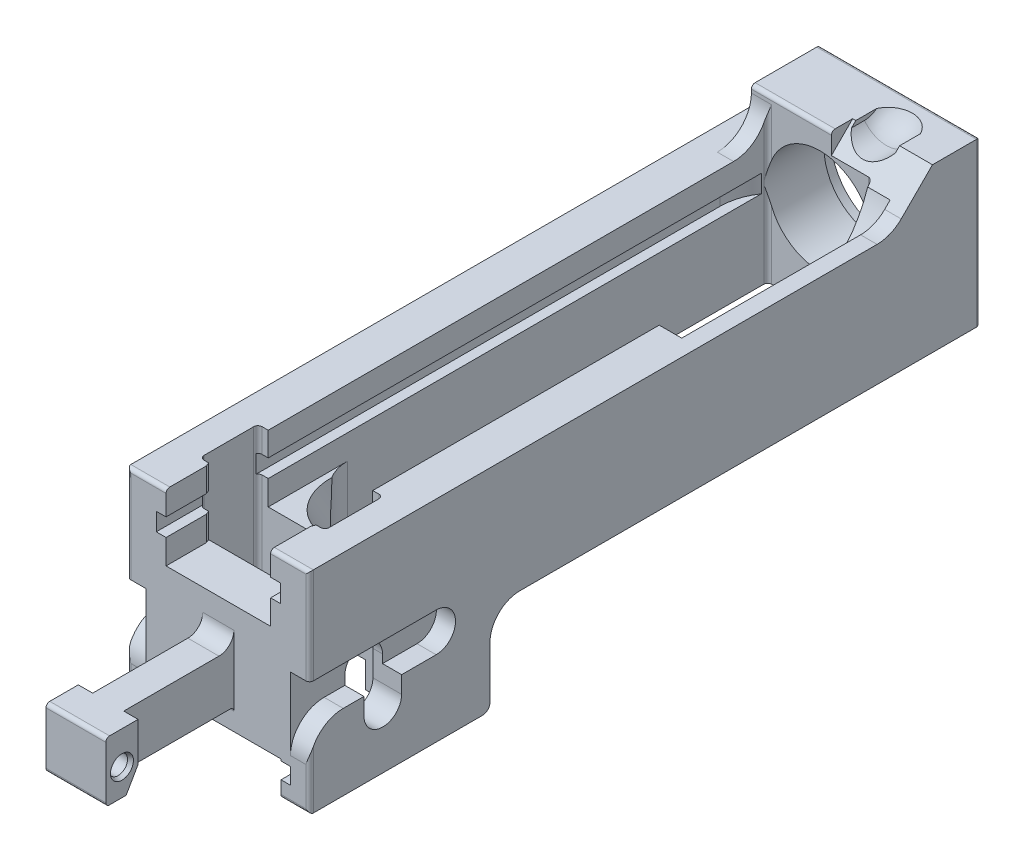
SolidWorks part; units mm, degrees
ref_plane "Спереди" through (0, 0, 0) normal (0, 0, 1) x (1, 0, 0)
ref_plane "Сверху" through (0, 0, 0) normal (0, 1, 0) x (1, 0, 0)
ref_plane "Справа" through (0, 0, 0) normal (1, 0, 0) x (0, 0, -1)
sketch "Эскиз1" plane through (0, 0, 0) normal (1, 0, 0) x (0, 0, -1)
  line L0 (-142.4178, 7.1882) -> (-21.8948, 7.1882)
  line L1 (-14.6558, 14.4272) -> (-14.6558, 15.1574)
  line L2 (-13.862, 15.9512) -> (0, 15.9512)
  line L3 (0, 15.9512) -> (0, -18.5928)
  line L4 (0, -18.5928) -> (-97.7646, -18.5928)
  line L5 (-104.1146, -24.9428) -> (-104.1146, -35.9537)
  line L6 (-105.7021, -37.5412) -> (-142.4178, -37.5412)
  line L7 (-142.4178, -37.5412) -> (-142.4178, 7.1882)
  line L8 (-126.873, -25.0825) -> (-126.873, -19.6723) construction
  line L9 (-130.8735, -25.0825) -> (-130.8735, -19.6723)
  line L10 (-122.8725, -25.0825) -> (-122.8725, -19.6723)
  arc A0 (-130.8735, -25.0825) -> (-122.8725, -25.0825) centre (-126.873, -25.0825) ccw
  arc A1 (-122.8725, -19.6723) -> (-130.8735, -19.6723) centre (-126.873, -19.6723) ccw
  arc A2 (-97.7646, -18.5928) -> (-104.1146, -24.9428) centre (-97.7646, -24.9428) ccw
  arc A3 (-21.8948, 7.1882) -> (-14.6558, 14.4272) centre (-21.8948, 14.4272) ccw
  arc A8 (-14.6558, 15.1574) -> (-13.862, 15.9512) centre (-13.862, 15.1574) cw
  arc A9 (-104.1146, -35.9537) -> (-105.7021, -37.5412) centre (-105.7021, -35.9537) cw
  point P11 (-126.873, -22.3774)
  dimension "D12" = 6.35
  dimension "D13" = 7.239
  dimension "D14" = 0.7937
  dimension "D15" = 1.5875
  dimension "D1" = 38.3032
  dimension "D2" = 14.6558
  dimension "D3" = 142.4178
  dimension "D4" = 37.5412
  dimension "D5" = 34.544
  dimension "D6" = 25.781
  dimension "D7" = 8.001
  dimension "D8" = 126.873
  dimension "D9" = 5.4102
  dimension "D10" = 12.4587
  dimension "D11" = 44.7294
extrude "Бобышка-Вытянуть1" add sketch "Эскиз1" along normal mid plane 38.7604
sketch "Эскиз2" plane through (0, 0, 0) normal (1, 0, 0) x (0, 0, -1)
  line L0 (-142.4178, -11.557) -> (-142.4178, -26.4478)
  line L1 (-145.5928, -14.732) -> (-172.6692, -14.732)
  line L2 (-172.6692, -14.732) -> (-172.6692, -27.432)
  line L3 (-172.6692, -27.432) -> (-168.3512, -27.432)
  line L4 (-163.9445, -25.654) -> (-143.2116, -25.654)
  line L5 (-142.4178, 7.1882) -> (-142.4178, -37.5412) construction
  line L6 (-142.4178, -37.5412) -> (-105.7021, -37.5412) construction
  line L7 (-97.7646, -18.5928) -> (0, -18.5928) construction
  arc A0 (-143.2116, -25.654) -> (-142.4178, -26.4478) centre (-143.2116, -26.4478) cw
  arc A1 (-145.5928, -14.732) -> (-142.4178, -11.557) centre (-145.5928, -11.557) ccw
  arc A2 (-168.3512, -27.432) -> (-163.9445, -25.654) centre (-163.9445, -32.004) cw
  circle A3 centre (-169.2402, -21.7678) radius 1.9812
  dimension "D1" = 3.175
  dimension "D2" = 0.7937
  dimension "D10" = 6.35
  dimension "D11" = 3.9624
  dimension "D3" = 22.8092
  dimension "D4" = 4.318
  dimension "D5" = 1.778
  dimension "D6" = 12.7
  dimension "D7" = 172.6692
  dimension "D8" = 26.8224
  dimension "D9" = 3.175
extrude "Бобышка-Вытянуть2" add sketch "Эскиз2" along normal mid plane 6.604
sketch "Эскиз3" plane through (0, 0, 0) normal (1, 0, 0) x (0, 0, -1)
  line L0 (-165.8112, -14.732) -> (-172.6692, -14.732)
  line L1 (-172.6692, -14.732) -> (-172.6692, -27.432)
  line L2 (-172.6692, -27.432) -> (-168.3512, -27.432)
  line L3 (-168.3512, -27.432) -> (-165.8112, -23.0326)
  line L4 (-165.8112, -23.0326) -> (-165.8112, -14.732)
  line L5 (-172.6692, -27.432) -> (-168.3512, -27.432) construction
  line L6 (-145.5928, -14.732) -> (-172.6692, -14.732) construction
  line L7 (-172.6692, -14.732) -> (-172.6692, -27.432) construction
  circle A0 centre (-169.2402, -21.7678) radius 1.9812
  circle A1 centre (-169.2402, -21.7678) radius 1.9812 construction
  dimension "D1" = 30
  dimension "D2" = 6.858
extrude "Бобышка-Вытянуть3" add sketch "Эскиз3" along normal mid plane 12.7
fillet "Скругление1" radius 0.7937 2 edges at (0, -27.432, 172.6692) (0, -14.732, 172.6692)
sketch "Эскиз6" plane through (0, -37.5412, 0) normal (0, -1, 0) x (1, 0, 0)
  line L0 (0, 0) -> (0, 156.9321) construction
  line L2 (12.3952, 120.7262) -> (-12.3952, 120.7262)
  line L3 (13.2842, 121.6152) -> (13.2842, 132.1816)
  line L4 (12.3952, 133.0706) -> (-12.3952, 133.0706)
  line L5 (-13.2842, 121.6152) -> (-13.2842, 132.1816)
  arc A0 (-12.3952, 133.0706) -> (-13.2842, 132.1816) centre (-12.3952, 132.1816) ccw
  arc A1 (-12.3952, 120.7262) -> (-13.2842, 121.6152) centre (-12.3952, 121.6152) cw
  arc A2 (12.3952, 120.7262) -> (13.2842, 121.6152) centre (12.3952, 121.6152) ccw
  arc A3 (13.2842, 132.1816) -> (12.3952, 133.0706) centre (12.3952, 132.1816) ccw
  dimension "D4" = 0.889
  dimension "D1" = 12.3444
  dimension "D2" = 120.7262
  dimension "D3" = 26.5684
extrude "Вырез-Вытянуть1" cut sketch "Эскиз6" against normal through all
sketch "Эскиз5" plane through (0, 15.9512, 0) normal (0, 1, 0) x (1, 0, 0)
  line L0 (0, 12.508) -> (0, -154.566) construction
  line L2 (-10.306, -14.6558) -> (10.306, -14.6558)
  line L3 (-11.0998, -15.4496) -> (-11.0998, -103.9177)
  line L4 (-2.3685, -112.649) -> (2.3685, -112.649)
  line L5 (11.0998, -15.4496) -> (11.0998, -103.9177)
  line L6 (-12.3952, -120.7262) -> (12.3952, -120.7262) construction
  line L7 (19.3802, 0) -> (-19.3802, 0) construction
  arc A0 (2.3685, -112.649) -> (11.0998, -103.9177) centre (2.3686, -103.9177) ccw
  arc A1 (-11.0998, -103.9177) -> (-2.3685, -112.649) centre (-2.3685, -103.9177) ccw
  arc A2 (10.306, -14.6558) -> (11.0998, -15.4496) centre (10.3061, -15.4495) cw
  arc A3 (-10.306, -14.6558) -> (-11.0998, -15.4496) centre (-10.306, -15.4495) ccw
  dimension "D4" = 8.7312
  dimension "D5" = 0.7937
  dimension "D1" = 22.1996
  dimension "D2" = 14.6558
  dimension "D3" = 8.0772
extrude "Вырез-Вытянуть2" cut sketch "Эскиз5" against normal through all
sketch "Эскиз7" plane through (0, 0, 0) normal (1, 0, 0) x (0, 0, -1)
  line L0 (0, 0) -> (-34.8934, 0) construction
  line L1 (0, 0) -> (0, 12.3571)
  line L2 (0, 12.3571) -> (-2.667, 12.3571)
  line L3 (-2.667, 12.3571) -> (-2.667, 11.11)
  line L4 (-2.667, 11.11) -> (-15.4496, 11.11)
  line L5 (-15.4496, 11.11) -> (-15.4496, 0)
  line L6 (-15.4496, 0) -> (0, 0)
  line L8 (-15.4496, -18.5928) -> (-15.4496, 11.1315) construction
  dimension "D1" = 24.7142
  dimension "D2" = 2.667
  dimension "D3" = 22.2199
revolve "Вырез-Повернуть1" cut sketch "Эскиз7" angle 360 about L0
sketch "Эскиз8" plane through (0, 7.1882, 0) normal (0, 1, 0) x (1, 0, 0)
  line L0 (-11.0998, -103.9177) -> (-11.0998, -21.8948) construction
  line L1 (-11.0998, -103.9177) -> (11.0998, -103.9177)
  line L2 (-11.0998, -103.9177) -> (-11.0998, -120.7262)
  line L3 (-11.0998, -142.4178) -> (11.0998, -142.4178)
  line L4 (11.0998, -103.9177) -> (11.0998, -120.7262)
  line L5 (11.0998, -21.8948) -> (11.0998, -103.9177) construction
  line L7 (11.8936, -130.0577) -> (11.8936, -120.7262)
  line L8 (11.8936, -120.7262) -> (11.0998, -120.7262)
  line L9 (-11.8935, -120.7262) -> (-11.8935, -130.0577)
  line L10 (12.3952, -133.0706) -> (-12.3952, -133.0706) construction
  line L11 (-12.3952, -120.7262) -> (12.3952, -120.7262) construction
  line L12 (-11.0998, -133.8644) -> (-11.0998, -142.4178)
  line L13 (11.0998, -133.8644) -> (11.0998, -142.4178)
  line L14 (-11.0998, -120.7262) -> (-11.8935, -120.7262)
  line L15 (19.3802, -142.4178) -> (-19.3802, -142.4178) construction
  arc A0 (-11.8935, -130.0577) -> (-11.0998, -133.8644) centre (-2.3685, -130.0577) ccw
  arc A1 (11.8936, -130.0577) -> (11.0998, -133.8644) centre (2.3686, -130.0577) cw
  dimension "D1" = 9.525
  dimension "D2" = 0.7937
  dimension "D3" = 0.7937
extrude "Вырез-Вытянуть3" cut sketch "Эскиз8" against normal blind 14.1224
sketch "Эскиз9" plane through (0, 0, 142.4178) normal (0, 0, 1) x (1, 0, 0)
  line L0 (0, 0) -> (0, -48.6902) construction
  line L1 (-13.3096, -30.226) -> (13.3096, -30.226)
  line L2 (13.3096, -30.226) -> (13.3096, -30.607)
  line L3 (13.3096, -30.607) -> (15.3162, -30.607)
  line L4 (15.3162, -30.607) -> (15.3162, -34.0614)
  line L5 (15.3162, -34.0614) -> (13.3096, -34.0614)
  line L6 (13.3096, -34.0614) -> (13.3096, -37.5412)
  line L7 (13.3096, -37.5412) -> (-13.3096, -37.5412)
  line L9 (-13.3096, -34.0614) -> (-13.3096, -37.5412)
  line L10 (-15.3162, -34.0614) -> (-13.3096, -34.0614)
  line L11 (-15.3162, -30.607) -> (-15.3162, -34.0614)
  line L12 (-13.3096, -30.607) -> (-15.3162, -30.607)
  line L13 (-13.3096, -30.226) -> (-13.3096, -30.607)
  line L14 (19.3802, -37.5412) -> (-19.3802, -37.5412) construction
  point P14 (0, -37.5412)
  point P19 (0, -30.226)
  dimension "D1" = 3.4798
  dimension "D2" = 3.4544
  dimension "D3" = 26.6192
  dimension "D4" = 30.6324
  dimension "D5" = 7.3152
extrude "Вырез-Вытянуть4" cut sketch "Эскиз9" against normal up to surface (38.3032 mm away)
ref_plane "Плоскость1" through (0, 2.0828, 0) normal (0, 1, 0) x (1, 0, 0)
sketch "Эскиз10" plane through (0, 2.0828, 0) normal (0, 1, 0) x (1, 0, 0)
  line L0 (0, 0) -> (0, -217.0194) construction
  line L1 (-11.0998, -142.4178) -> (11.0998, -142.4178) construction
  line L2 (-10.0076, -14.6558) -> (10.0076, -14.6558)
  line L3 (-13.1826, -22.6628) -> (-13.1826, -142.4178)
  line L4 (-13.1826, -142.4178) -> (13.1826, -142.4178)
  line L5 (13.1826, -22.6628) -> (13.1826, -142.4178)
  line L6 (19.3802, -14.6558) -> (-19.3802, -14.6558) construction
  arc A0 (-13.1826, -22.6628) -> (-10.0076, -14.6558) centre (-1.4986, -22.6628) cw
  arc A1 (13.1826, -22.6628) -> (10.0076, -14.6558) centre (1.4986, -22.6628) ccw
  dimension "D2" = 11.684
  dimension "D1" = 26.3652
  dimension "D3" = 3.175
extrude "Вырез-Вытянуть5" cut sketch "Эскиз10" against normal blind 3.7846
fillet "Скругление2" radius 0.7937 10 edges at (19.3802, -1.3208, 0) (0, 15.9512, 0) (-19.3802, -1.3208, 0) (0, -18.5928, 0) (-16.3449, -37.5412, 142.4178) (16.3449, -37.5412, 142.4178) (19.3802, -15.1765, 142.4178) (15.24, 7.1882, 142.4178) (-15.24, 7.1882, 142.4178) (-19.3802, -15.1765, 142.4178)
sketch "Эскиз11" plane through (19.3802, 0, 0) normal (1, 0, 0) x (0, 0, -1)
  line L0 (-142.4178, -28.6068) -> (-142.4178, -13.2334)
  line L2 (-142.4178, -13.2334) -> (-115.5446, -13.2334)
  line L3 (-135.2741, -21.463) -> (-115.5446, -21.463)
  line L4 (-141.6241, -37.5412) -> (-105.7021, -37.5412) construction
  line L5 (-142.4178, -26.4478) -> (-142.4178, -11.557) construction
  arc A0 (-115.5446, -21.463) -> (-115.5446, -13.2334) centre (-115.5446, -17.3482) ccw
  arc A1 (-142.4178, -28.6068) -> (-135.2741, -21.463) centre (-135.2741, -28.6068) cw
  point P11 (-111.4298, -17.3482)
  dimension "D2" = 7.1437
  dimension "D1" = 24.3078
  dimension "D3" = 8.2296
  dimension "D4" = 30.988
extrude "Вырез-Вытянуть6" cut sketch "Эскиз11" against normal blind 4.064
mirror "Зеркальное отражение1" about plane through (0, 0, 0) normal (1, 0, 0) of "Вырез-Вытянуть6"
chamfer "Фаска1" distance 0.7937 angle 30 2 edges at (-6.35, -21.7678, 167.259) (6.35, -21.7678, 167.259)
sketch "Эскиз12" plane through (0, 0, 0) normal (1, 0, 0) x (0, 0, -1)
  line L0 (-119.0426, 11.0826) -> (-89.8309, -39.5136) construction
  line L1 (-111.4636, -2.0447) -> (-119.9325, -6.9342)
  line L2 (-119.9325, -6.9342) -> (-103.662, -35.1155)
  line L3 (-103.662, -35.1155) -> (-95.1931, -30.226)
  line L4 (-95.1931, -30.226) -> (-111.4636, -2.0447)
  line L5 (-120.7262, -6.9342) -> (-120.7262, -1.7018) construction
  line L6 (-103.9177, -6.9342) -> (-120.7262, -6.9342) construction
  line L7 (-104.1146, -30.226) -> (-142.4178, -30.226) construction
  dimension "D1" = 9.779
  dimension "D2" = 30
  dimension "D3" = 0.7937
revolve "Вырез-Повернуть2" cut sketch "Эскиз12" angle 360 about L0
sketch "Эскиз13" plane through (0, -37.5412, 0) normal (0, -1, 0) x (1, 0, 0)
  line L0 (-12.3952, 120.7262) -> (12.3952, 120.7262) construction
  line L1 (9.5885, 97.7646) -> (-9.5885, 97.7646)
  line L2 (9.5885, 97.7646) -> (9.5885, 120.7262)
  line L3 (9.5885, 120.7262) -> (-9.5885, 120.7262)
  line L4 (-9.5885, 97.7646) -> (-9.5885, 120.7262)
  line L7 (19.3802, 97.7646) -> (11.0998, 97.7646) construction
  line L8 (0, 97.7646) -> (0, 0) construction
  dimension "D1" = 19.177
extrude "Вырез-Вытянуть8" cut sketch "Эскиз13" against normal blind 12.827 contours L1 L4 L3 L2
sketch "Эскиз14" plane through (0, 0, 0) normal (0, 0, -1) x (-1, 0, 0)
  line L1 (14.5542, 15.9512) -> (19.3802, 15.9512)
  line L2 (14.5542, 15.9512) -> (14.5542, 7.1882)
  line L3 (14.5542, 7.1882) -> (19.3802, 7.1882)
  line L4 (19.3802, 15.9512) -> (19.3802, 7.1882)
  line L7 (11.0998, 7.1882) -> (19.3802, 7.1882) construction
  line L8 (-19.3802, 15.9512) -> (19.3802, 15.9512) construction
  line L9 (19.3802, 15.9512) -> (19.3802, -18.5928) construction
  dimension "D1" = 4.826
extrude "Вырез-Вытянуть9" cut sketch "Эскиз14" against normal through all
sketch "Эскиз15" plane through (13.2842, 0, 0) normal (-1, 0, 0) x (0, 0, 1)
  line L0 (132.1816, -30.226) -> (134.6581, -30.226)
  line L1 (134.6581, -30.226) -> (132.1816, -27.7495)
  line L2 (132.1816, 7.1882) -> (132.1816, -30.226) construction
  line L3 (132.1816, -27.7495) -> (132.1816, -30.226)
  line L4 (133.0706, -1.7018) -> (133.0706, -30.226) construction
  dimension "D1" = 1.5875
  dimension "D2" = 45
extrude "Вырез-Вытянуть10" cut sketch "Эскиз15" along normal up to surface (26.5684 mm away)
sketch "Эскиз16" plane through (11.0998, 0, 0) normal (-1, 0, 0) x (0, 0, 1)
  line L0 (21.8948, 7.1882) -> (120.7262, 7.1882) construction
  line L2 (142.4178, 7.1882) -> (142.4178, -13.2334) construction
  circle A0 centre (38.4048, 17.6022) radius 23.876
  point P7 (38.4048, -6.2738)
  dimension "D1" = 23.876
  dimension "D2" = 104.013
  dimension "D3" = 13.462
extrude "Вырез-Вытянуть11" cut sketch "Эскиз16" against normal offset from surface (4.7752 mm away) 3.5052
sketch "Эскиз17" plane through (19.3802, 0, 0) normal (1, 0, 0) x (0, 0, -1)
  line L0 (-10.1333, 15.9512) -> (-16.7761, 15.9512)
  line L1 (-0.7937, 15.9512) -> (-13.862, 15.9512) construction
  line L2 (-16.7761, 15.9512) -> (-16.7761, 9.3085)
  line L3 (-16.7761, 9.3085) -> (-10.1333, 15.9512)
  arc A0 (-21.8948, 7.1882) -> (-14.6558, 14.4272) centre (-21.8948, 14.4272) ccw construction
  dimension "D1" = 45
extrude "Вырез-Вытянуть12" cut sketch "Эскиз17" against normal blind 16.9418
ref_plane "Плоскость2" through (7.747, 0, 0) normal (-1, 0, 0) x (0, 0, 1)
sketch "Эскиз18" plane through (7.747, 0, 0) normal (-1, 0, 0) x (0, 0, 1)
  line L0 (14.6558, 12.7508) -> (8.292, 12.7508)
  line L1 (0.7937, 15.9512) -> (10.1333, 15.9512) construction
  line L2 (0, -18.5928) -> (0, 15.9512) construction
  line L3 (14.6558, 15.1574) -> (14.6558, 11.4287) construction
  arc A0 (8.292, 12.7508) -> (2.7781, 15.9512) centre (8.292, 19.1008) cw
  dimension "D1" = 6.35
  dimension "D2" = 3.2004
  dimension "D3" = 2.7781
sketch "Эскиз19" plane through (0, 0, 14.6558) normal (0, 0, 1) x (1, 0, 0)
  line L0 (7.747, 12.7508) -> (7.747, 22.7869) construction
  line L1 (3.0988, 15.0376) -> (3.0988, 19.1008)
  line L2 (3.0988, 19.1008) -> (12.3952, 19.1008)
  line L3 (12.3952, 19.1008) -> (12.3952, 15.0376)
  arc A0 (3.0988, 15.0376) -> (12.3952, 15.0376) centre (7.747, 18.6182) ccw
  point P3 (7.747, 12.7508)
  dimension "D3" = 5.8674
  dimension "D1" = 9.2964
  dimension "D2" = 6.35
sweep "Вырез-По траектории1" cut profiles "Эскиз19" path "Эскиз18"
sketch "Эскиз20" plane through (-19.3802, 0, 0) normal (-1, 0, 0) x (0, 0, 1)
  line L0 (31.75, 4.0386) -> (0, 4.0386)
  line L1 (0, 4.0386) -> (0, -4.0386)
  line L2 (0, -4.0386) -> (31.75, -4.0386)
  line L3 (0, 0) -> (54.1782, 0) construction
  line L4 (51.0032, 3.175) -> (34.2459, 3.175)
  line L6 (34.2459, -3.175) -> (51.0032, -3.175)
  arc A0 (31.75, 4.0386) -> (34.2459, 3.175) centre (31.75, 0) cw
  arc A1 (51.0032, 3.175) -> (51.0032, -3.175) centre (51.0032, 0) cw
  arc A2 (34.2459, -3.175) -> (31.75, -4.0386) centre (31.75, 0) cw
  dimension "D3" = 3.175
  dimension "D1" = 8.0772
  dimension "D2" = 31.75
  dimension "D4" = 54.1782
extrude "Вырез-Вытянуть13" cut sketch "Эскиз20" against normal blind 2.032
sketch "Эскиз21" plane through (-17.3482, 0, 0) normal (-1, 0, 0) x (0, 0, 1)
  line L0 (51.0032, 4.0386) -> (0, 4.0386)
  line L1 (0, 4.0386) -> (0, -4.0386)
  line L2 (0.7937, -4.0386) -> (31.75, -4.0386) construction
  line L3 (0, -4.0386) -> (51.0032, -4.0386)
  line L4 (31.75, 4.0386) -> (0.7937, 4.0386) construction
  line L5 (0, 4.0386) -> (0, -4.0386) construction
  arc A0 (51.0032, -4.0386) -> (51.0032, 4.0386) centre (51.0032, 0) ccw
  arc A2 (51.0032, -3.175) -> (51.0032, 3.175) centre (51.0032, 0) ccw construction
extrude "Вырез-Вытянуть14" cut sketch "Эскиз21" along normal offset from surface (1.3208 mm away) 0.7112
equation "\"D9@Эскиз1\"=0.528-\"D7@Эскиз1\""
equation "\"D10@Эскиз1\"=0.333+\"D7@Эскиз1\"/2"
